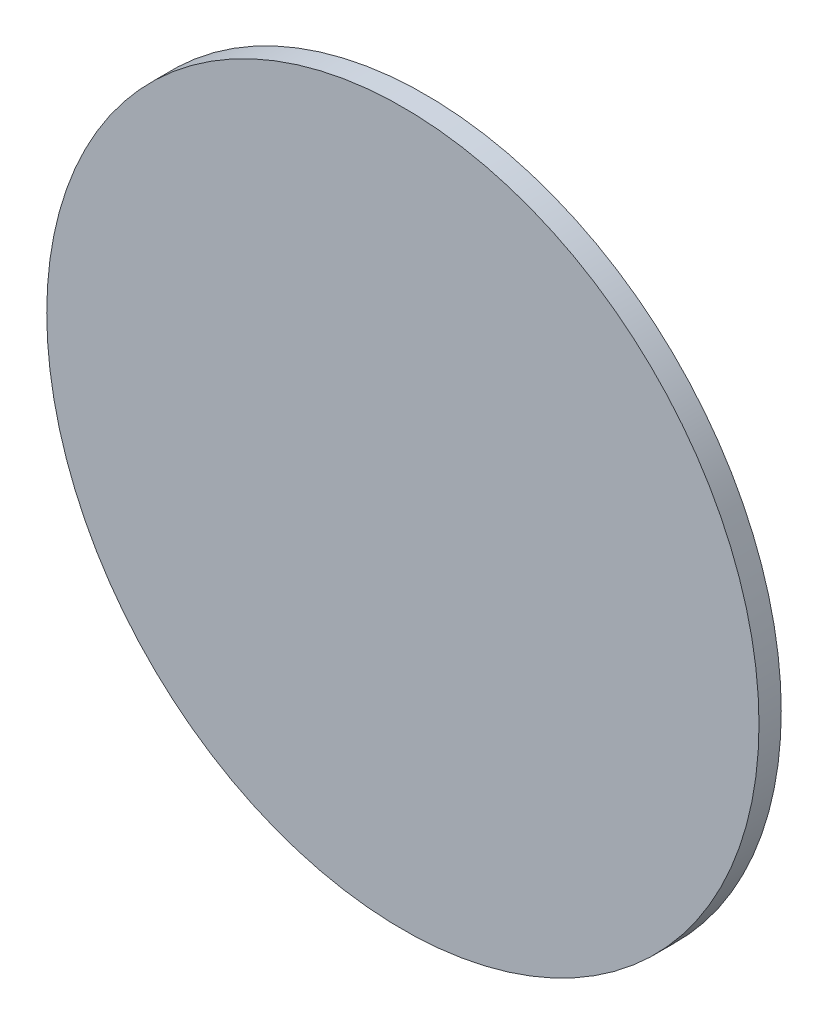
SolidWorks part; units mm, degrees
ref_plane "Front Plane" through (0, 0, 0) normal (0, 0, 1) x (1, 0, 0)
ref_plane "Top Plane" through (0, 0, 0) normal (0, 1, 0) x (1, 0, 0)
ref_plane "Right Plane" through (0, 0, 0) normal (1, 0, 0) x (0, 0, -1)
sketch "Sketch1" plane through (0, 0, 0) normal (0, 0, 1) x (1, 0, 0)
  circle A0 centre (0, 0) radius 16
  dimension "D1" = 32
extrude "Extrude1" add sketch "Sketch1" along normal blind 1
